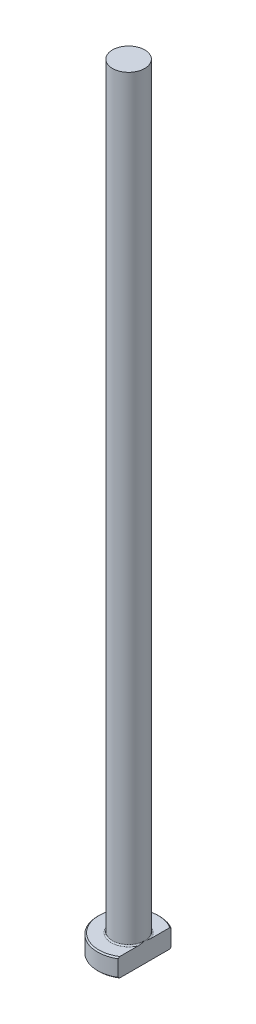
SolidWorks part; units mm, degrees
ref_plane "Front Plane" through (0, 0, 0) normal (0, 0, 1) x (1, 0, 0)
ref_plane "Top Plane" through (0, 0, 0) normal (0, 1, 0) x (1, 0, 0)
ref_plane "Right Plane" through (0, 0, 0) normal (1, 0, 0) x (0, 0, -1)
sketch "Sketch1" plane through (0, 0, 0) normal (0, 0, 1) x (1, 0, 0)
  line L0 (0, 259.9588) -> (0, -15.1925) construction
  line L1 (0, 0) -> (-5, 0)
  line L2 (-5, 0) -> (-5, 3)
  line L3 (-5, 3) -> (-2.6, 3)
  line L4 (-2.6, 3) -> (-2.6, 125)
  line L5 (-2.6, 125) -> (0, 125)
  line L6 (0, 125) -> (0, 0)
  dimension "L" = 125
  dimension "H" = 10
  dimension "T" = 3
  dimension "D" = 5.2
revolve "Revolve1" add sketch "Sketch1" angle 360 about L0
chamfer "Chamfer1" distance 0.2 angle 45 2 edges at (0, 3, 5) (0, 0, 5)
fillet "Fillet1" radius 0.2 1 edges at (0, 3, 2.6)
sketch "Sketch2" plane through (0, 0, 0) normal (0, 1, 0) x (1, 0, 0)
  line L0 (2.6, 4.2708) -> (2.6, -4.2708)
  circle A0 centre (0, 0) radius 5 construction
  arc A1 (2.6, -4.2708) -> (2.6, 4.2708) centre (0, 0) ccw
  circle A2 centre (0, 0) radius 2.6 construction
extrude "KEY" cut sketch "Sketch2" along normal through all
